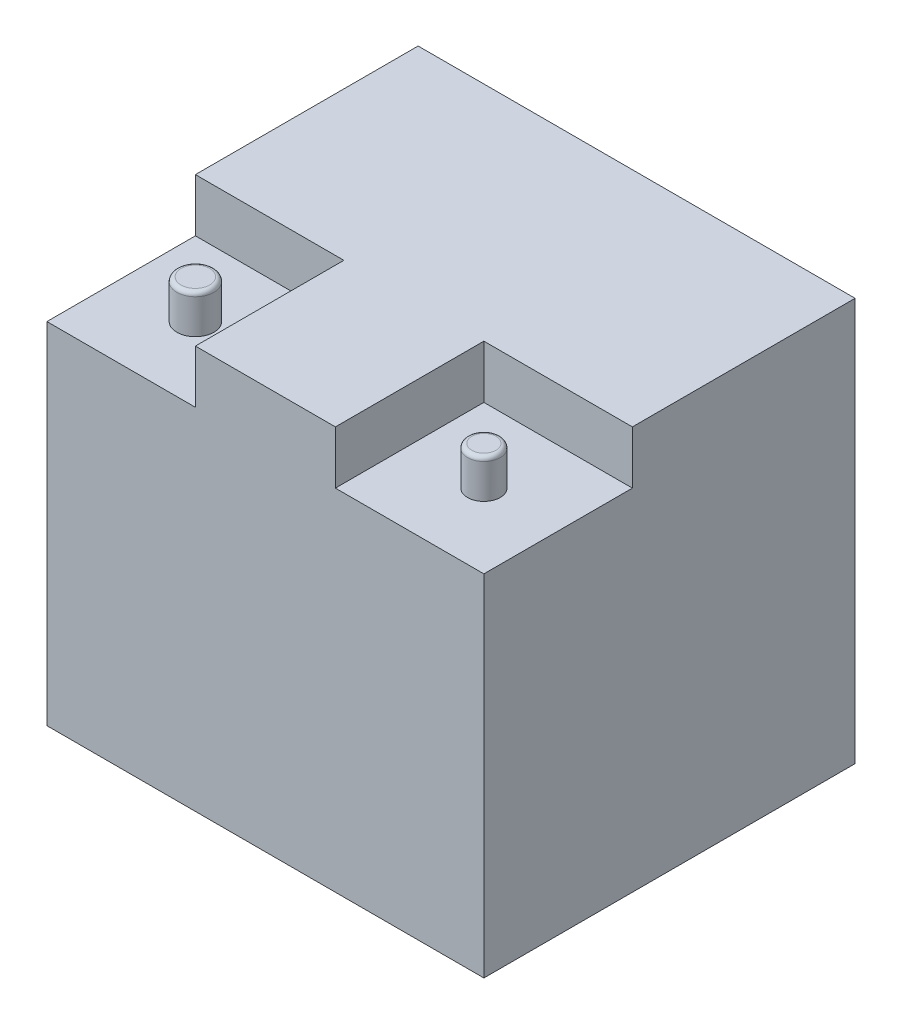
SolidWorks part; units mm, degrees
ref_plane "Plan de face" through (0, 0, 0) normal (0, 0, 1) x (1, 0, 0)
ref_plane "Plan de dessus" through (0, 0, 0) normal (0, 1, 0) x (1, 0, 0)
ref_plane "Plan de droite" through (0, 0, 0) normal (1, 0, 0) x (0, 0, -1)
sketch "Esquisse1" plane through (0, 0, 0) normal (0, 1, 0) x (1, 0, 0)
  line L0 (-103, 87.5) -> (103, -87.5) construction
  line L1 (-103, 87.5) -> (103, 87.5)
  line L2 (-103, 87.5) -> (-103, -87.5)
  line L3 (-103, -87.5) -> (103, -87.5)
  line L4 (103, 87.5) -> (103, -87.5)
  dimension "D1" = 206
  dimension "D2" = 175
extrude "Extrusion1" add sketch "Esquisse1" along normal blind 190
sketch "Esquisse2" plane through (0, 190, 0) normal (0, 1, 0) x (-1, 0, 0)
  line L0 (103, 87.5) -> (-103, 87.5) construction
  line L1 (103, 87.5) -> (33, 87.5)
  line L2 (103, 87.5) -> (103, 17.5)
  line L3 (103, 17.5) -> (33, 17.5)
  line L4 (33, 87.5) -> (33, 17.5)
  line L5 (-33, 87.5) -> (-103, 87.5)
  line L6 (-33, 87.5) -> (-33, 17.5)
  line L7 (-33, 17.5) -> (-103, 17.5)
  line L8 (-103, 87.5) -> (-103, 17.5)
  line L9 (-103, 87.5) -> (-103, -87.5) construction
  dimension "D1" = 70
  dimension "D2" = 70
extrude "Enlèv. mat.-Extru.1" cut sketch "Esquisse2" against normal blind 25
sketch "Esquisse3" plane through (0, 165, 0) normal (0, 1, 0) x (-1, 0, 0)
  line L0 (-33, 87.5) -> (-103, 17.5) construction
  line L1 (103, 17.5) -> (33, 87.5) construction
  circle A0 centre (68, 52.5) radius 8.75
  circle A1 centre (-68, 52.5) radius 7.7
  dimension "D1" = 17.5
  dimension "D2" = 15.4
extrude "Extrusion2" add sketch "Esquisse3" along normal blind 18.3
fillet "Congé1" radius 2 2 edges at (-68, 183.3, 61.25) (68, 183.3, 60.2)
